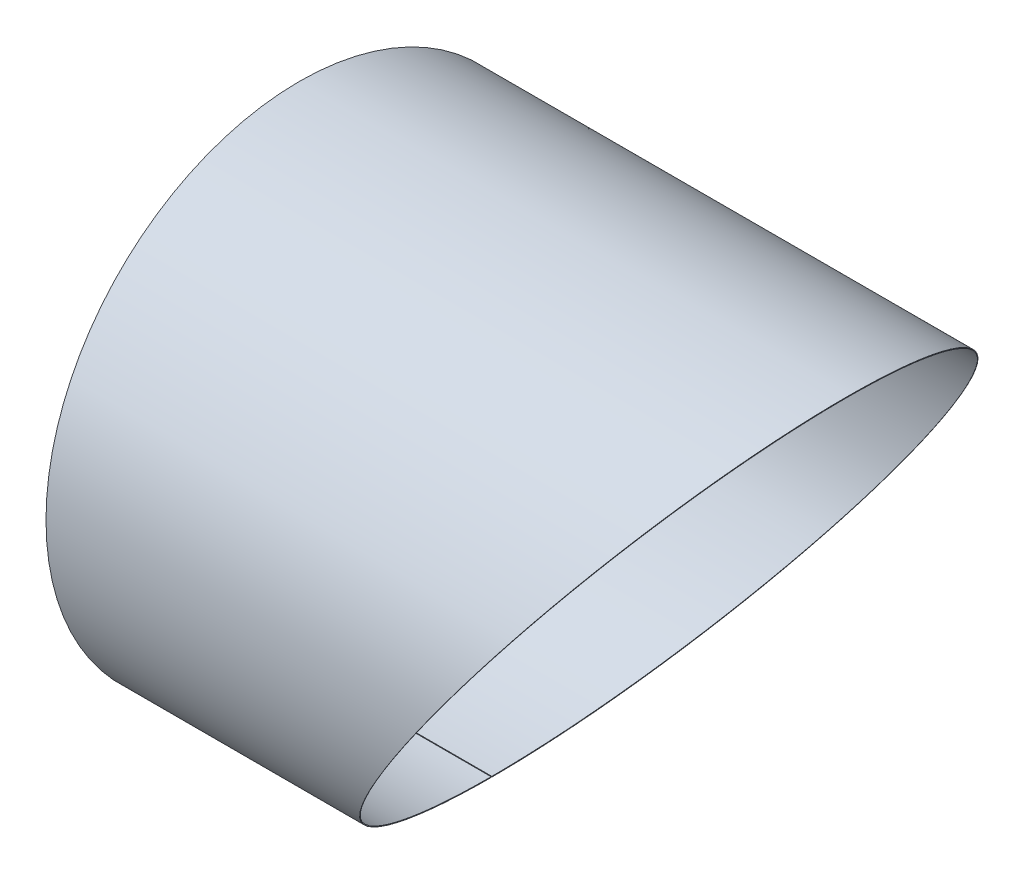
SolidWorks part; units mm, degrees
ref_plane "前视基准面" through (0, 0, 0) normal (0, 0, 1) x (1, 0, 0)
ref_plane "上视基准面" through (0, 0, 0) normal (0, 1, 0) x (1, 0, 0)
ref_plane "右视基准面" through (0, 0, 0) normal (1, 0, 0) x (0, 0, -1)
imported_body "基体零件-两节90°弯头-1"
sheet metal parameters "钣金1" parameters "D1"=0.7366, "厚度"=1
bend "圆角折弯1" bend radius 359 bend angle 359.841 parameters "D5"=1
flatten bends "展开-折弯1" parameters "D1"=0
sketch "尖角-草图1" plane through (136.5406, 390.0003, -0.5) normal (0, -1, -0.0014) x (1, 0, 0)
  line L0 (136.5406, -1127.3332) -> (-136.5406, -1127.3332) construction
process bends "加工-折弯1" parameters "D1"=0
sketch "平面-草图1" plane through (136.5406, 390.0003, -0.5) normal (0, -1, -0.0014) x (1, 0, 0)
